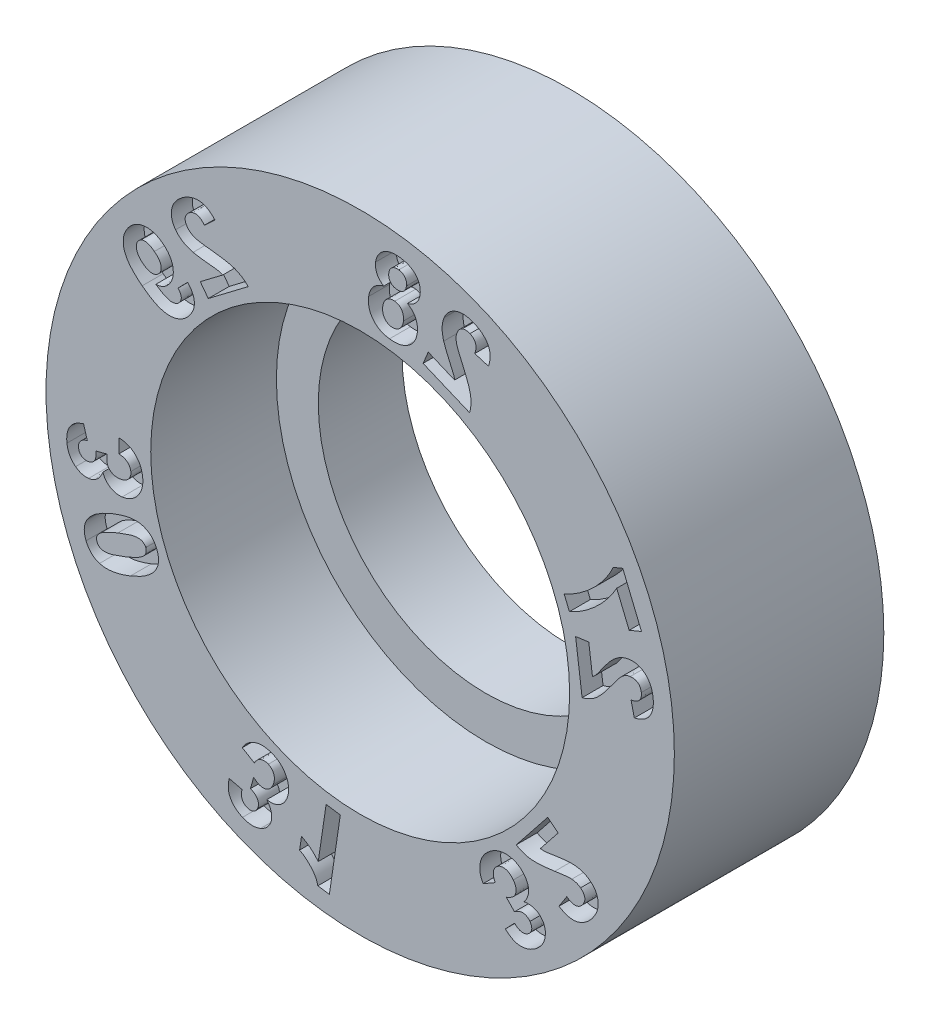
SolidWorks part; units mm, degrees
ref_plane "Front Plane" through (0, 0, 0) normal (0, 0, 1) x (1, 0, 0)
ref_plane "Top Plane" through (0, 0, 0) normal (0, 1, 0) x (1, 0, 0)
ref_plane "Right Plane" through (0, 0, 0) normal (1, 0, 0) x (0, 0, -1)
imported_body "Imported1"
other "DeleteFace2"
sketch "Sketch1" plane through (0, 0, 0) normal (0, 0, 1) x (1, 0, 0)
  line L0 (0, 0) -> (0, 8.7827) construction
  line L1 (0, 0) -> (7.606, 4.3913) construction
  line L2 (0, 0) -> (7.606, -4.3913) construction
  line L3 (0, 0) -> (0, -8.7827) construction
  line L4 (0, 0) -> (-7.606, -4.3913) construction
  line L5 (0, 0) -> (-7.606, 4.3913) construction
  circle A0 centre (0, 0) radius 5.3057 construction
  text T0 "27    28    29    30    31    32" font "Arial" height 1.8
  point P11 (0, 0)
  dimension "D1" = 6
extrude "Cut-Extrude1" cut sketch "Sketch1" against normal blind 0.5
